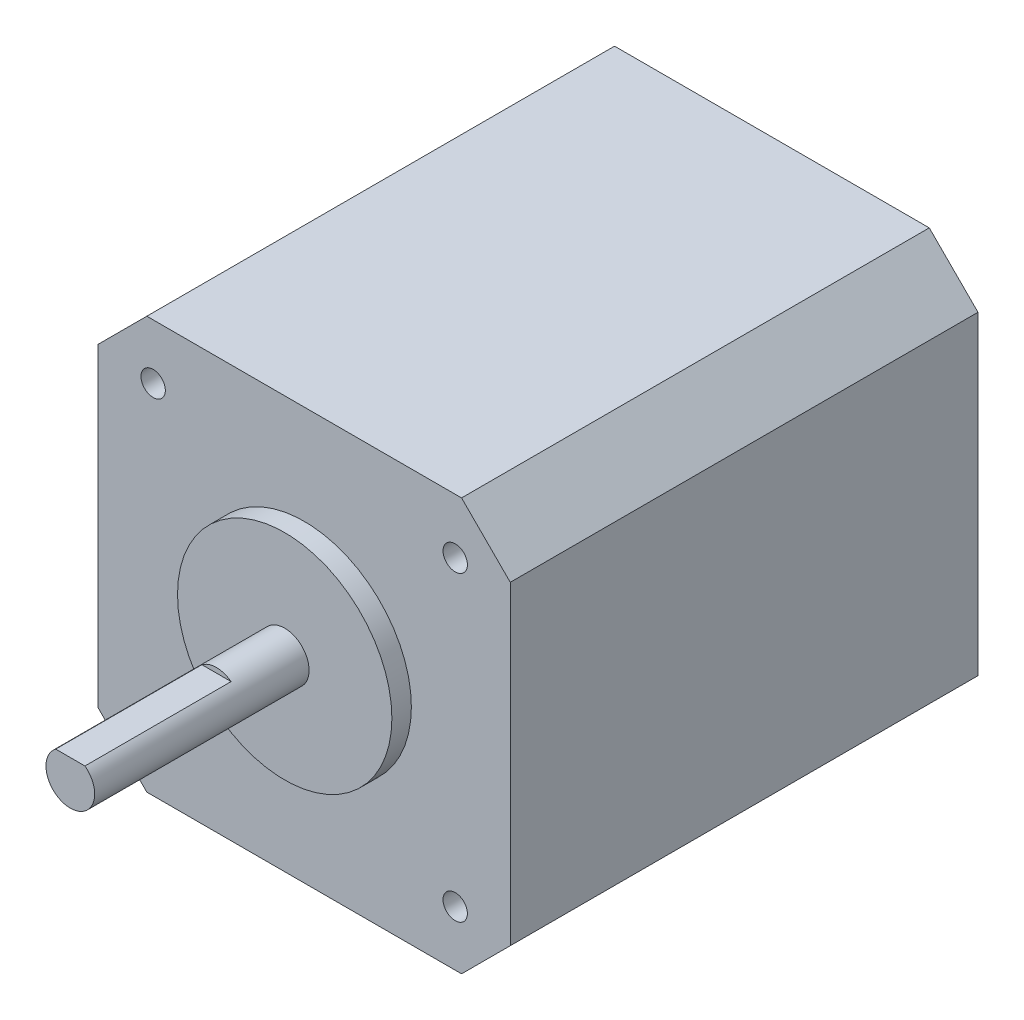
SolidWorks part; units mm, degrees
ref_plane "Front Plane" through (0, 0, 0) normal (0, 0, 1) x (1, 0, 0)
ref_plane "Top Plane" through (0, 0, 0) normal (0, 1, 0) x (1, 0, 0)
ref_plane "Right Plane" through (0, 0, 0) normal (1, 0, 0) x (0, 0, -1)
sketch "Sketch2" plane through (0, 0, 0) normal (0, 0, 1) x (1, 0, 0)
  line L0 (-21.15, -21.15) -> (21.15, -21.15)
  line L1 (-21.15, -21.15) -> (-21.15, 21.15)
  line L2 (-21.15, 21.15) -> (21.15, 21.15)
  line L3 (21.15, -21.15) -> (21.15, 21.15)
  line L4 (-21.15, -21.15) -> (21.15, 21.15) construction
  line L5 (-21.15, 21.15) -> (21.15, -21.15) construction
  point P0 (0, 0)
  dimension "D1" = 42.3
extrude "Boss-Extrude1" add sketch "Sketch2" along normal mid plane 48
hole_wizard "M3 Tapped Hole1" positions "3DSketch2" profile "Sketch6" tap size "M3" standard "ISO"
sketch3d "3DSketch2"
  line L0 (-21.15, 21.15, 24) -> (21.15, -21.15, 24) construction
  line L2 (-21.15, -21.15, 24) -> (21.15, 21.15, 24) construction
  point P0 (-15.5, 15.5, 24)
  point P2 (15.5, 15.5, 24)
  point P4 (15.5, -15.5, 24)
  point P6 (-15.5, -15.5, 24)
  dimension "D1" = 31
sketch "Sketch6" plane through (-15.5, 15.5, 24) normal (1, 0, 0) x (0, -1, 0)
  line L0 (0, 0) -> (0, 5.2511)
  line L1 (0, 5.2511) -> (1.25, 4.5)
  line L2 (1.25, 4.5) -> (1.25, 0)
  line L5 (1.25, 0) -> (0, 0)
  line L10 (0, 5.2511) -> (-1.25, 4.5) construction
  line L11 (0, -6.35) -> (0, 107.95) construction
  dimension "Tap Drill Dia." = 2.5
  dimension "Tap Drill Depth" = 4.5
  dimension "Drill Angle" = 118
chamfer "Chamfer1" distance 5 angle 45 4 edges at (-21.15, 21.15, 0) (-21.15, -21.15, 0) (21.15, -21.15, 0) (21.15, 21.15, 0)
sketch "Sketch7" plane through (0, 0, 24) normal (0, 0, 1) x (1, 0, 0)
  circle A0 centre (0, 0) radius 11
  dimension "D1" = 22
extrude "Boss-Extrude2" add sketch "Sketch7" along normal blind 2
sketch "Sketch8" plane through (0, 0, 26) normal (0, 0, 1) x (1, 0, 0)
  circle A0 centre (0, 0) radius 2.5
  dimension "D1" = 5
extrude "Boss-Extrude3" add sketch "Sketch8" along normal blind 22
sketch "Sketch9" plane through (0, 0, 48) normal (0, 0, 1) x (1, 0, 0)
  line L0 (-1.5, 2) -> (1.5, 2)
  circle A0 centre (0, 0) radius 2.5 construction
  arc A1 (1.5, 2) -> (-1.5, 2) centre (0, 0) ccw
  dimension "D1" = 4.5
extrude "Cut-Extrude1" cut sketch "Sketch9" against normal blind 15
